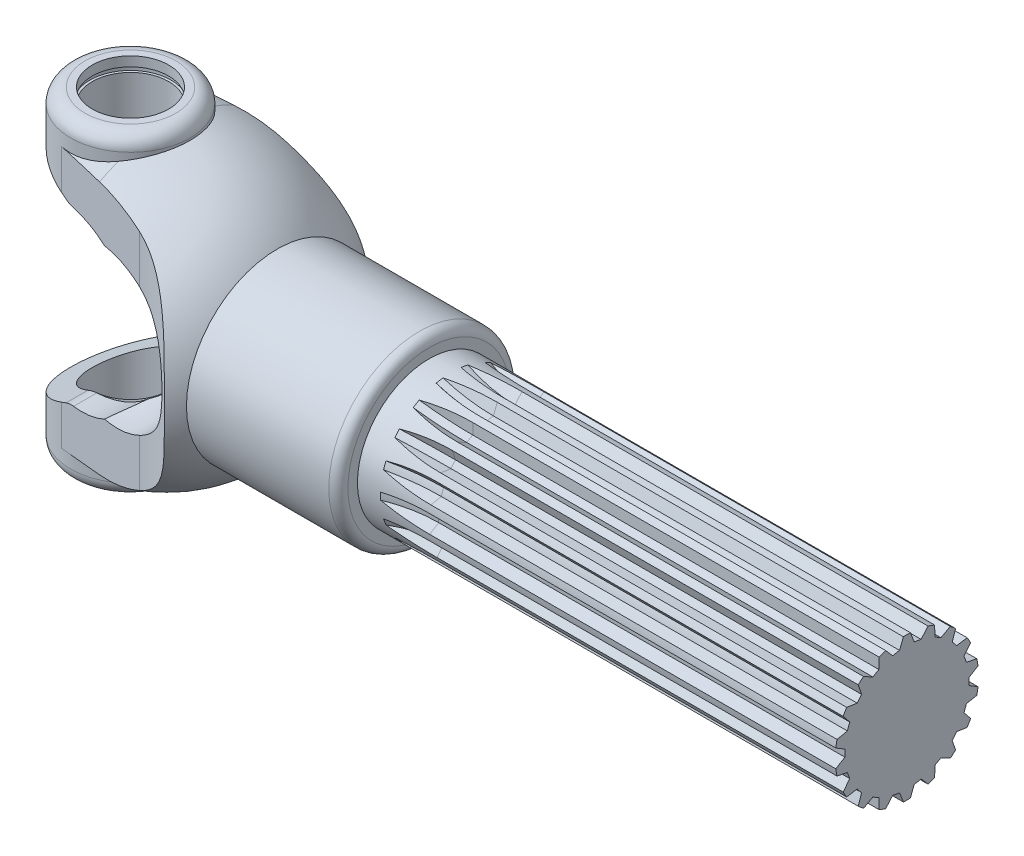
SolidWorks part; units mm, degrees
ref_plane "Front Plane" through (0, 0, 0) normal (0, 0, 1) x (1, 0, 0)
ref_plane "Top Plane" through (0, 0, 0) normal (0, 1, 0) x (1, 0, 0)
ref_plane "Right Plane" through (0, 0, 0) normal (1, 0, 0) x (0, 0, -1)
sketch "Sketch1" plane through (0, 0, 0) normal (0, 0, 1) x (1, 0, 0)
  line L0 (-12.5, 0) -> (162.5, 0)
  line L1 (162.5, 0) -> (162.5, 15)
  line L2 (30.7164, 19) -> (62.5, 19)
  line L3 (7.5, 30) -> (-12.5, 30)
  line L4 (-12.5, 30) -> (-12.5, 0)
  line L5 (62.5, 19) -> (62.5, 15)
  line L6 (62.5, 15) -> (162.5, 15)
  arc A0 (30.7164, 19) -> (7.5, 30) centre (7.5, 0) ccw
  dimension "D3" = 30
  dimension "D4" = 19
  dimension "D1" = 15
  dimension "D2" = 30
  dimension "D5" = 12.5
  dimension "D6" = 20
  dimension "D7" = 175
  dimension "D8" = 100
revolve "Revolve1" add sketch "Sketch1" angle 360 about L0
sketch "Sketch2" plane through (0, 0, 0) normal (0, 1, 0) x (1, 0, 0)
  line L0 (28.5, -21.4243) -> (28.5, -41.4243)
  line L1 (28.5, -21.4243) -> (25.0936, -24.7633) construction
  line L2 (28.5, -21.4243) -> (29.6509, -22.5985) construction
  line L3 (-12.5, 0) -> (41.0657, 0) construction
  line L4 (-12.5, 30) -> (-12.5, -30) construction
  line L5 (-2.1199, -12.3189) -> (17.609, -15.714)
  line L6 (-2.1199, 12.3189) -> (17.609, 15.714)
  line L7 (28.5, -41.4243) -> (-41.5, -41.4243)
  line L8 (-41.5, -41.4243) -> (-41.5, 41.4243)
  line L9 (-41.5, 41.4243) -> (28.5, 41.4243)
  line L10 (28.5, 41.4243) -> (28.5, 21.4243)
  arc A0 (-2.1199, 12.3189) -> (-2.1199, -12.3189) centre (0, 0) ccw
  arc A2 (17.609, -15.714) -> (28.5, -21.4243) centre (14.2171, -35.4243) cw
  arc A3 (7.5, -30) -> (30.7164, -19) centre (7.5, 0) ccw construction
  arc A4 (7.5, -30) -> (30.7164, -19) centre (7.5, 0) ccw construction
  arc A5 (7.5, -30) -> (30.7164, -19) centre (7.5, 0) ccw construction
  arc A6 (17.609, 15.714) -> (28.5, 21.4243) centre (14.2171, 35.4243) ccw
  dimension "D1" = 25
  dimension "D2" = 20
  dimension "D3" = 20
  dimension "D4" = 70
  dimension "D5" = 41
extrude "Cut-Extrude1" cut sketch "Sketch2" against normal through all both and the other way through all
sketch "Sketch3" plane through (0, 0, 0) normal (0, 0, 1) x (1, 0, 0)
  line L0 (-12.5, 24) -> (0, 18)
  line L1 (-12.5, 30) -> (-12.5, -30) construction
  line L4 (0, 18) -> (0, -18)
  line L5 (24, 0) -> (0, 0) construction
  line L7 (-12.5, -24) -> (0, -18)
  line L9 (-12.5, 24) -> (-12.5, -24)
  dimension "D1" = 12.5
  dimension "D3" = 6
  dimension "D4" = 12
extrude "Cut-Extrude2" cut sketch "Sketch3" against normal through all both and the other way through all
sketch "Sketch7" plane through (0, 0, 0) normal (1, 0, 0) x (0, 0, -1)
  line L0 (0, 0) -> (0, 43.6765) construction
  line L1 (-20, 18) -> (-8, 18)
  line L2 (12.6837, 18) -> (-12.6837, 18) construction
  line L5 (20, 18) -> (8, 18)
  line L6 (-20, 18) -> (-20, 0)
  line L8 (-20, 0) -> (20, 0)
  line L9 (20, 0) -> (20, 18)
  arc A0 (8, 18) -> (-8, 18) centre (0, 0) ccw
  dimension "D1" = 16
  dimension "D3" = 40
revolve "Cut-Revolve2" cut sketch "Sketch7" angle 360 about L8
fillet "Fillet1" radius 5 4 edges at (0, -18, -10.3419) (0, -18, 10.3419) (0, 18, -10.3419) (0, 18, 10.3419)
sketch "Sketch4" plane through (0, 0, 0) normal (0, 0, 1) x (1, 0, 0)
  line L0 (-9.5, 33) -> (0, 33)
  line L1 (0, 33) -> (0, 24)
  line L2 (0, 24) -> (-12.5, 24)
  line L3 (-12.5, 30) -> (-12.5, 24) construction
  line L4 (-12.5, 24) -> (-12.5, 30)
  line L5 (7.5, 30) -> (-12.5, 30) construction
  arc A0 (-12.5, 30) -> (-9.5, 33) centre (-9.5, 30) cw
  dimension "D1" = 3
revolve "Revolve2" add sketch "Sketch4" angle 360 about L1
mirror "Mirror1" about plane through (0, 0, 0) normal (0, 1, 0) of "Revolve2"
sketch "Sketch5" plane through (0, 33, 0) normal (0, 1, 0) x (1, 0, 0)
  circle A0 centre (0, 0) radius 8
  dimension "D1" = 16
extrude "Cut-Extrude3" cut sketch "Sketch5" against normal through all
sketch "Sketch6" plane through (0, 0, 0) normal (0, 0, 1) x (1, 0, 0)
  line L0 (8, 31) -> (8.5, 31)
  line L1 (8.5, 31) -> (8.5, 30)
  line L2 (8.5, 30) -> (8, 30)
  line L3 (8, 30) -> (8, 31)
  line L4 (0, 0) -> (0, 47.1154) construction
  line L5 (9.5, 33) -> (-9.5, 33) construction
  line L7 (0, 0) -> (51.1336, 0) construction
  line L8 (8, -30) -> (8, -31)
  line L9 (8.5, -30) -> (8, -30)
  line L10 (8.5, -31) -> (8.5, -30)
  line L11 (8, -31) -> (8.5, -31)
  dimension "D1" = 8
  dimension "D2" = 2
  dimension "D3" = 1
  dimension "D4" = 0.5
revolve "Cut-Revolve1" cut sketch "Sketch6" angle 360 about L4
sketch "Sketch8" plane through (0, 0, 0) normal (0, 1, 0) x (1, 0, 0)
  line L0 (19.374, 3.5567) -> (6.3836, 11.0567)
  line L1 (-11.0329, -19.1096) -> (22.7452, 39.3958) construction
  line L4 (6.3836, 11.0567) -> (14.5636, 25.2249)
  line L5 (14.5636, 25.2249) -> (25.5, 18.9107)
  line L6 (0, 0) -> (0, 51.0803) construction
  line L7 (18, 15.7853) -> (18, 8)
  line L8 (18, 15.7853) -> (18, 8) construction
  arc A0 (19.374, 3.5567) -> (25.5, 18.9107) centre (5.5215, 17.9827) ccw
  arc A1 (18, 15.7853) -> (28.5, 21.4243) centre (14.2171, 35.4243) ccw
  arc A2 (18, 15.7853) -> (28.5, 21.4243) centre (14.2171, 35.4243) ccw construction
  arc A3 (18, -8) -> (18, 8) centre (0, 0) ccw
  arc A4 (18, -8) -> (18, 8) centre (0, 0) ccw construction
  point P15 (25.5, 18.9107)
  dimension "D1" = 15
  dimension "D4" = 3
  dimension "D2" = 30
  dimension "D3" = 20
revolve "Cut-Revolve3" cut sketch "Sketch8" angle 360 about L1
mirror "Mirror2" about plane through (0, 0, 0) normal (0, 0, 1) of "Cut-Revolve3"
fillet "Fillet2" radius 2 1 edges at (62.5, 0, 19)
sketch "Sketch9" plane through (162.5, 0, 0) normal (1, 0, 0) x (0, 0, -1)
  line L0 (0, 0) -> (0, 15) construction
  line L1 (0, 0) -> (2.6047, 14.7721) construction
  line L2 (0.7327, 14.9821) -> (1.5393, 12.9086)
  line L3 (0, 0) -> (1.5393, 12.9086) construction
  line L4 (4.4356, 14.3292) -> (2.9686, 12.6565)
  line L5 (0, 0) -> (0.7327, 14.9821) construction
  circle A0 centre (0, 0) radius 15 construction
  arc A2 (2.9686, 12.6565) -> (1.5393, 12.9086) centre (0, 0) ccw
  arc A3 (4.4356, 14.3292) -> (0.7327, 14.9821) centre (0, 0) ccw
  circle A4 centre (0, 0) radius 15 construction
  dimension "D4" = 13
  dimension "D1" = 2.8
  dimension "D2" = 4
  dimension "D3" = 3.2
ref_plane "Plane1" through (0, 0, 0) normal (0, -0.1736, -0.9848) x (0, 0.9848, -0.1736)
sketch "Sketch10" plane through (0, 0, 0) normal (0, 0.1736, 0.9848) x (1, 0, 0)
  line L0 (162.5, 15) -> (77.5, 15)
  line L1 (162.5, 0) -> (162.5, 15) construction
  line L2 (162.5, 15) -> (62.5, 15) construction
  line L3 (62.5, -15) -> (62.5, 15) construction
  arc A0 (77.5, 15) -> (66.5, 17.5501) centre (77.5, 40) cw
  dimension "D2" = 25
  dimension "D1" = 15
  dimension "D3" = 4
sweep "Cut-Sweep1" cut profiles "Sketch9" path "Sketch10"
pattern_circular "CirPattern1" count 18 over 360 about axis through (0, 0, 0) along (1, 0, 0) of "Cut-Sweep1"
